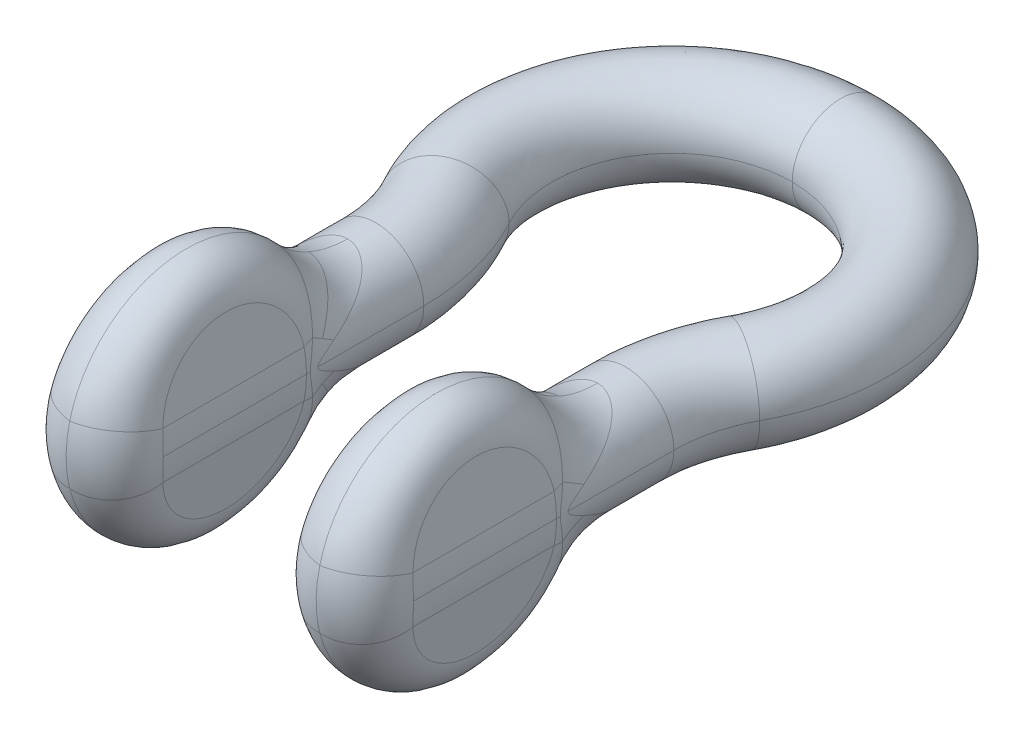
SolidWorks part; units mm, degrees
ref_plane "Front Plane" through (0, 0, 0) normal (0, 0, 1) x (1, 0, 0)
ref_plane "Top Plane" through (0, 0, 0) normal (0, 1, 0) x (1, 0, 0)
ref_plane "Right Plane" through (0, 0, 0) normal (1, 0, 0) x (0, 0, -1)
imported_body "Surface Repair.IGS<1>"
surface "Surface-Fill1"
surface "Surface-Fill2"
surface "Surface-Fill3"
surface "Surface-Fill4"
